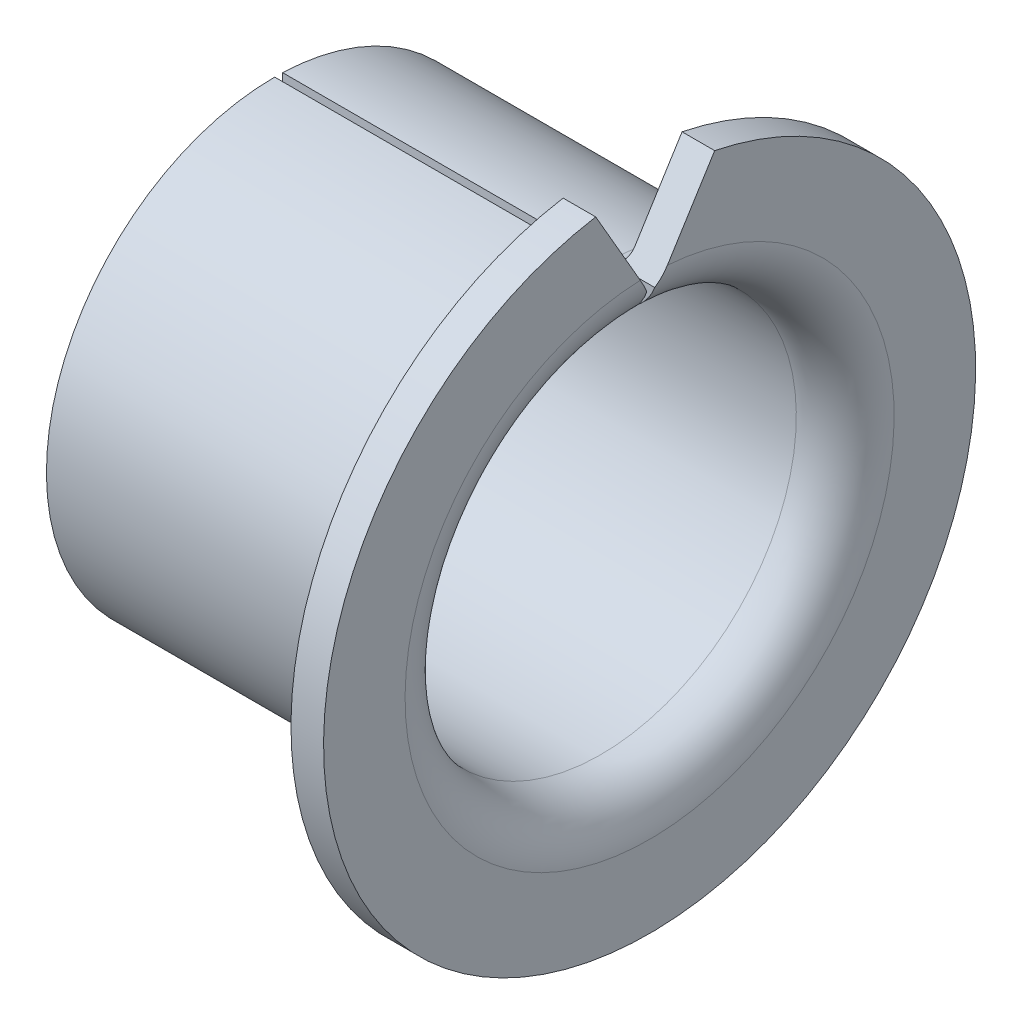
SolidWorks part; units mm, degrees
ref_plane "Plan1" through (0, 0, 0) normal (0, 0, 1) x (1, 0, 0)
ref_plane "Plan2" through (0, 0, 0) normal (0, 1, 0) x (1, 0, 0)
ref_plane "Plan3" through (0, 0, 0) normal (1, 0, 0) x (0, 0, -1)
sketch "Esquisse1" plane through (0, 0, 0) normal (0, 0, 1) x (1, 0, 0)
  line L0 (0, 0) -> (11.5, 0) construction
  line L1 (0, 7) -> (10, 7)
  line L2 (0, 7) -> (0, 6)
  line L3 (0, 6) -> (10, 6)
  line L4 (11.5, 10) -> (11.5, 7.5)
  line L5 (10.5, 7.5) -> (10.5, 10)
  line L6 (10.5, 10) -> (11.5, 10)
  line L7 (40, 14) -> (38, 16) construction
  arc A0 (10.5, 7.5) -> (10, 7) centre (10, 7.5) cw
  arc A1 (10, 6) -> (11.5, 7.5) centre (10, 7.5) ccw
  dimension "D5" = 0.5
  dimension "D6" = 1.5
  dimension "D1" = 6
  dimension "D2" = 7
  dimension "D3" = 11.5
  dimension "D4" = 10
  dimension "D7" = 1
revolve "Base-Révolution" add sketch "Esquisse1" angle 358 about L0
sketch "Esquisse2" plane through (0, 0, 0) normal (1, 0, 0) x (0, 0, -1)
  line L0 (0.349, 9.9939) -> (0.2617, 7.4954) construction
  line L1 (0.349, 9.9939) -> (0.2617, 7.4954) construction
  line L2 (0, 10) -> (0, 7.5) construction
  line L3 (0, 10) -> (0, 7.5) construction
  line L4 (0, 7) -> (0, 7.5) construction
  line L5 (0, 7) -> (0, 7.5) construction
  line L6 (0.2617, 7.4954) -> (0.2443, 6.9957) construction
  line L7 (0.2617, 7.4954) -> (0.2443, 6.9957) construction
  line L8 (0.2443, 6.9957) -> (2.08, 9.9335)
  line L9 (0, 7) -> (-1.7321, 10)
  line L10 (0, 10) -> (-1.7321, 10)
  line L11 (0.349, 9.9939) -> (2.08, 9.9335)
  line L12 (0.349, 9.9939) -> (0, 10)
  line L13 (0, 7) -> (0.2443, 6.9957)
  arc A1 (0, 10) -> (0.349, 9.9939) centre (0, 0) ccw construction
  dimension "D1" = 30
  dimension "D2" = 30
extrude "Enlèv. mat.-Extru.3" cut sketch "Esquisse2" along normal through all
equation "\"D7@Esquisse1\"=\"D2@Esquisse1\"-\"D1@Esquisse1\""
equation "\"D6@Esquisse1\" = \"D5@Esquisse1\"+\"D7@Esquisse1\""
